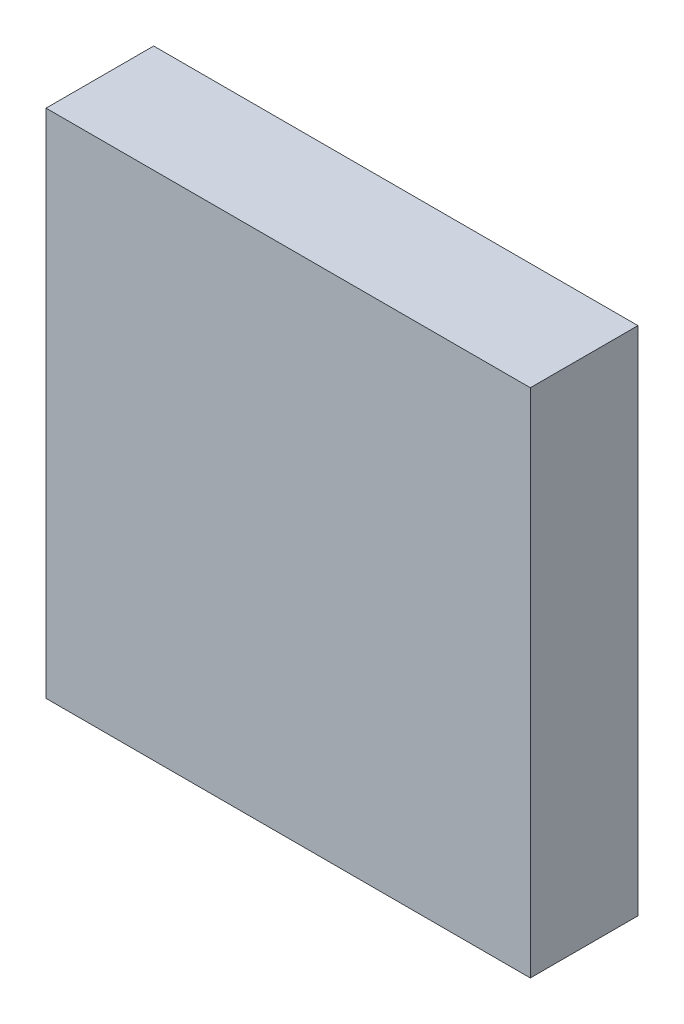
SolidWorks part; units mm, degrees
ref_plane "Plan de face" through (0, 0, 0) normal (0, 0, 1) x (1, 0, 0)
ref_plane "Plan de dessus" through (0, 0, 0) normal (0, 1, 0) x (1, 0, 0)
ref_plane "Plan de droite" through (0, 0, 0) normal (1, 0, 0) x (0, 0, -1)
sketch "Esquisse1" plane through (0, 0, 0) normal (0, 0, 1) x (1, 0, 0)
  line L1 (0, 0) -> (90, 0)
  line L2 (0, 0) -> (0, 95)
  line L3 (0, 95) -> (90, 95)
  line L4 (90, 0) -> (90, 95)
  dimension "D1" = 95
  dimension "D2" = 90
extrude "Boss.-Extru.1" add sketch "Esquisse1" along normal blind 20
